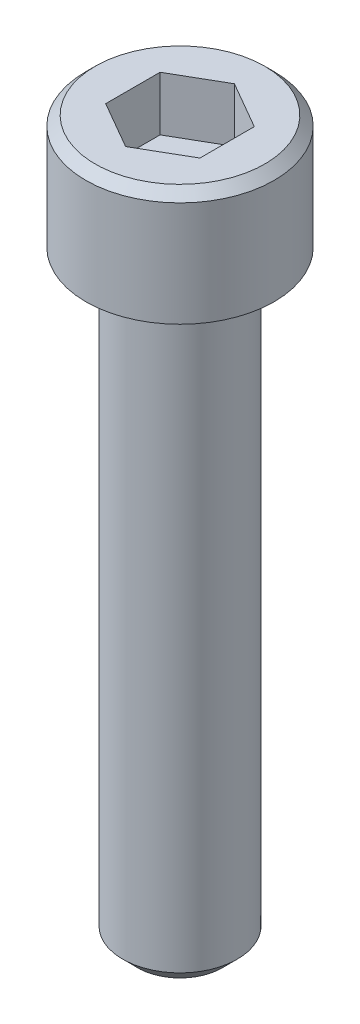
SolidWorks part; units mm, degrees
ref_plane "Front" through (0, 0, 0) normal (0, 0, 1) x (1, 0, 0)
ref_plane "Top" through (0, 0, 0) normal (0, 1, 0) x (1, 0, 0)
ref_plane "Right" through (0, 0, 0) normal (1, 0, 0) x (0, 0, -1)
sketch "Sketch1" plane through (0, 0, 0) normal (0, 0, 1) x (1, 0, 0)
  line L0 (0, 0) -> (3.9688, 0)
  line L1 (3.9688, 0) -> (3.9688, 4.4291)
  line L2 (3.9688, 4.4291) -> (3.5719, 4.826)
  line L3 (3.5719, 4.826) -> (0, 4.826)
  line L4 (0, 4.826) -> (0, 0)
  line L5 (0, 0) -> (0, 100) construction
revolve "Base-Revolve" add sketch "Sketch1" angle 360 about L5
sketch "Sketch2" plane through (0, 0, 0) normal (0, 0, 1) x (1, 0, 0)
  line L0 (0, 0) -> (0, 26.9912) construction
  line L1 (0, -25.4) -> (1.7831, -25.4)
  line L2 (1.7831, -25.4) -> (2.413, -24.7701)
  line L3 (2.413, -24.7701) -> (2.413, 0)
  line L4 (2.413, 0) -> (0, 0)
  line L5 (0, 0) -> (0, -25.4)
  line L6 (-3.9688, 0) -> (3.9688, 0) construction
  dimension "D1" = 225
  dimension "D2" = 4.826
  dimension "D3" = 0.6299
  dimension "D4" = 25.4
revolve "Boss-Revolve1" add sketch "Sketch2" angle 360 about L0
ref_plane "Plane4" through (0, 4.826, 0) normal (0, 1, 0) x (-1, 0, 0)
sketch "Sketch3" plane through (0, 4.826, 0) normal (0, 1, 0) x (-1, 0, 0)
  line L0 (1.985, 1.146) -> (0, 2.2921)
  line L1 (0, 2.2921) -> (-1.985, 1.146)
  line L2 (-1.985, 1.146) -> (-1.985, -1.146)
  line L3 (-1.985, -1.146) -> (0, -2.2921)
  line L4 (0, -2.2921) -> (1.985, -1.146)
  line L5 (1.985, -1.146) -> (1.985, 1.146)
extrude "Cut-Extrude1" cut sketch "Sketch3" against normal blind 2.286
